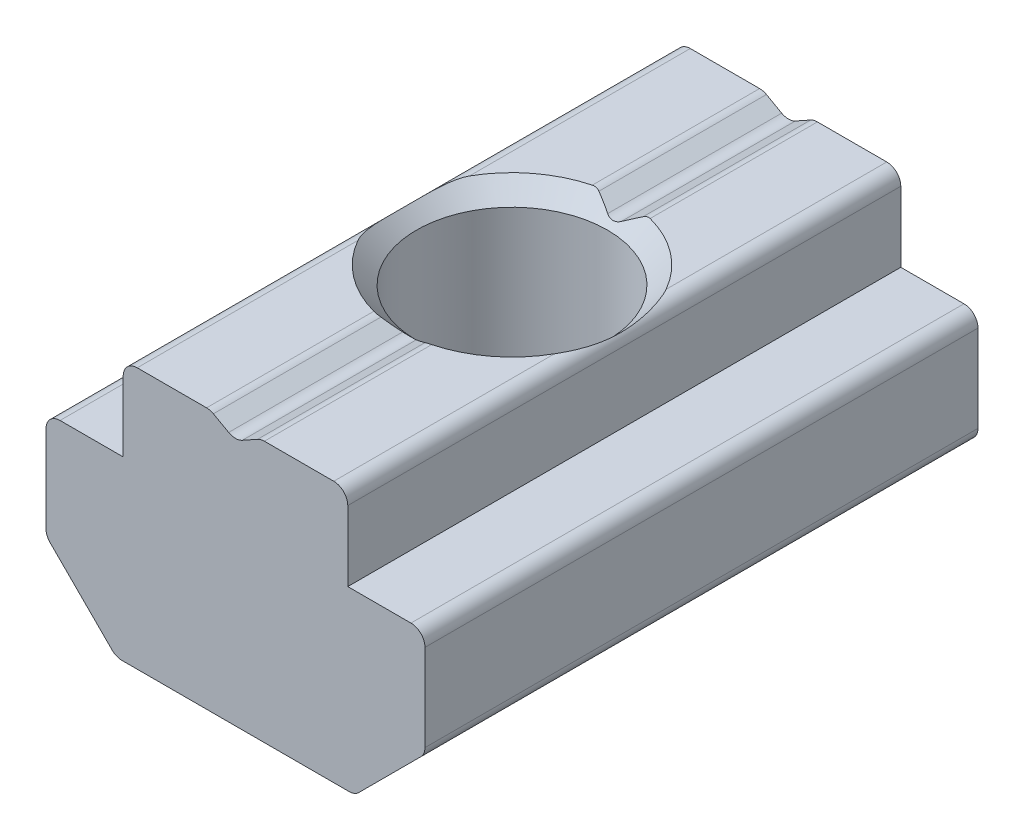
SolidWorks part; units mm, degrees
ref_plane "Front Plane" through (0, 0, 0) normal (0, 0, 1) x (1, 0, 0)
ref_plane "Top Plane" through (0, 0, 0) normal (0, 1, 0) x (1, 0, 0)
ref_plane "Right Plane" through (0, 0, 0) normal (1, 0, 0) x (0, 0, -1)
sketch "Sketch1" plane through (0, 0, 0) normal (0, 1, 0) x (1, 0, 0)
  line L1 (0, 0) -> (13.5, 0)
  line L2 (0, 0) -> (0, 19.7)
  line L3 (0, 19.7) -> (13.5, 19.7)
  line L4 (13.5, 0) -> (13.5, 19.7)
  dimension "D1" = 13.5
  dimension "D2" = 19.7
extrude "Boss-Extrude1" add sketch "Sketch1" along normal blind 9.3
sketch "Sketch2" plane through (0, 9.3, 0) normal (0, 1, 0) x (1, 0, 0)
  line L6 (13.5, 19.7) -> (0, 19.7) construction
  line L7 (2.75, 19.7) -> (10.75, 19.7)
  line L8 (2.75, 19.7) -> (2.75, 0)
  line L9 (2.75, 0) -> (10.75, 0)
  line L10 (10.75, 19.7) -> (10.75, 0)
  line L11 (0, 0) -> (13.5, 0) construction
  line L13 (2.75, 19.7) -> (0, 19.7)
  line L14 (2.75, 19.7) -> (2.75, 0)
  line L15 (2.75, 0) -> (0, 0)
  line L16 (0, 19.7) -> (0, 0)
  line L17 (10.75, 19.7) -> (13.5, 19.7)
  line L18 (10.75, 19.7) -> (10.75, 0)
  line L19 (10.75, 0) -> (13.5, 0)
  line L20 (13.5, 19.7) -> (13.5, 0)
  point P4 (6.75, 19.7)
  point P7 (6.75, 19.7)
  point P8 (6.75, 0)
  point P11 (6.75, 0)
  dimension "D1" = 8
extrude "Cut-Extrude1" cut sketch "Sketch2" against normal blind 3 contours L8 M8 M5 M6 | L10 M8 M6 M7
chamfer "Chamfer1" distance 2.5 angle 45 2 edges at (0, 0, -9.85) (13.5, 0, -9.85)
hole_wizard "M8 Tapped Hole1" positions "Sketch3" profile "Sketch5" tap size "M8" standard "ISO"
sketch "Sketch3" plane through (0, 9.3, 0) normal (0, 1, 0) x (1, 0, 0)
  point P0 (6.75, 9.85)
sketch "Sketch5" plane through (6.75, 9.3, -9.85) normal (1, 0, 0) x (0, 0, 1)
  line L0 (0, 0) -> (0, 9.3)
  line L1 (0, 9.3) -> (4.025, 9.3)
  line L2 (3.4, 8.675) -> (3.4, 0.625)
  line L3 (3.4, 0.625) -> (4.025, 0)
  line L5 (4.025, 0) -> (0, 0)
  line L6 (-3.4, 0.625) -> (-4.025, 0) construction
  line L7 (4.025, 9.3) -> (3.4, 8.675)
  line L8 (-4.025, 9.3) -> (-3.4, 8.675) construction
  line L11 (0, -6.35) -> (0, 107.95) construction
  dimension "Thread Major Dia." = 6.8
  dimension "Thru Tap Drill Depth" = 9.3
  dimension "Near C'Sink Dia." = 8.05
  dimension "Near C'Sink Angle" = 90
  dimension "Far C'Sink Dia." = 8.05
  dimension "Far C'Sink Angle" = 90
sketch "Sketch6" plane through (0, 0, 0) normal (0, 0, 1) x (1, 0, 0)
  line L0 (6.75, 9.3) -> (6.75, 4.2106) construction
  line L1 (2.75, 9.3) -> (10.75, 9.3) construction
  line L2 (5.85, 9.3) -> (7.65, 9.3)
  line L3 (6.75, 9.3) -> (6.75, 8.8)
  line L4 (5.85, 9.3) -> (6.75, 8.8)
  line L5 (7.65, 9.3) -> (6.75, 8.8)
  point P6 (6.75, 9.3)
  dimension "D1" = 1.8
  dimension "D2" = 0.5
extrude "Cut-Extrude2" cut sketch "Sketch6" against normal up to surface (19.7 mm away) contours L2 L4 L3 | L5 L3 M16
fillet "Fillet1" radius 0.5 16 edges at (0, 2.5, -9.85) (2.5, 0, -9.85) (11, 0, -9.85) (13.5, 2.5, -9.85) (10.75, 9.3, -14.999) (10.75, 9.3, -4.701) (13.5, 6.3, -9.85) (0, 6.3, -9.85) (2.75, 9.3, -14.999) (2.75, 9.3, -4.701) (6.75, 8.8, -16.5375) (6.75, 8.8, -3.1625) (7.65, 9.3, -2.9635) (5.85, 9.3, -2.9635) (7.65, 9.3, -16.7365) (5.85, 9.3, -16.7365)
